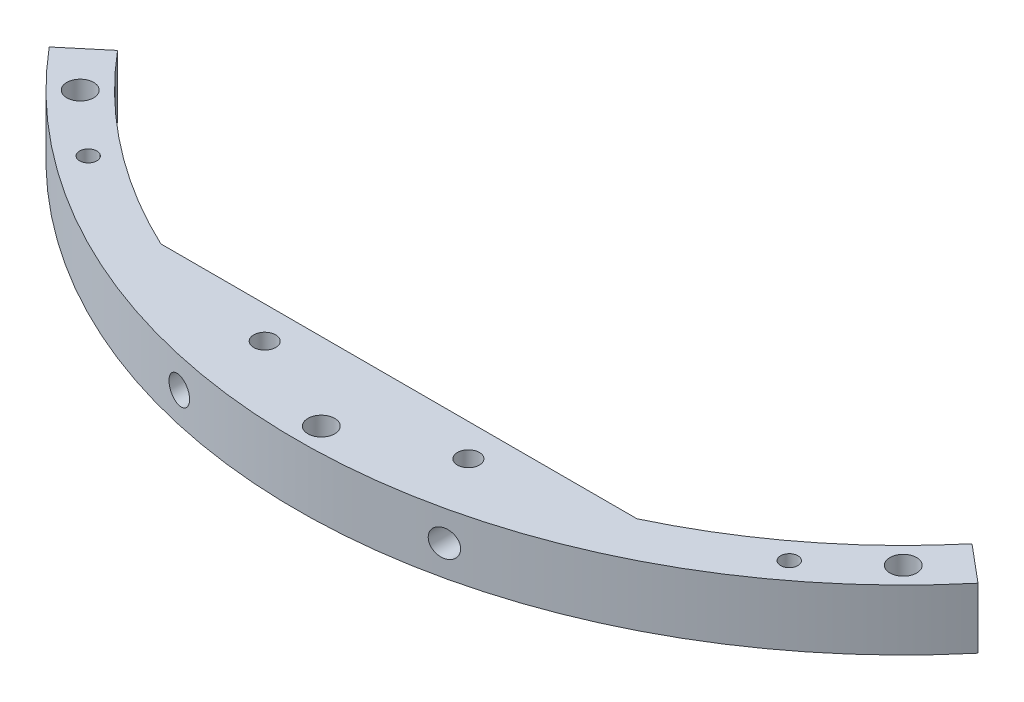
SolidWorks part; units mm, degrees
ref_plane "Front Plane" through (0, 0, 0) normal (0, 0, 1) x (1, 0, 0)
ref_plane "Top Plane" through (0, 0, 0) normal (0, 1, 0) x (1, 0, 0)
ref_plane "Right Plane" through (0, 0, 0) normal (1, 0, 0) x (0, 0, -1)
sketch "Sketch1" plane through (0, 0, 0) normal (0, 1, 0) x (1, 0, 0)
  line L0 (-67.1285, -56.3275) -> (-72.9657, -61.2255)
  line L1 (0, 0) -> (0, -103.3133) construction
  line L2 (67.1285, -56.3275) -> (72.9657, -61.2255)
  line L3 (37.4002, -79.248) -> (-37.4002, -79.248)
  arc A0 (-72.9657, -61.2255) -> (72.9657, -61.2255) centre (0, 0) ccw
  arc A1 (-67.1285, -56.3275) -> (-37.4002, -79.248) centre (0, 0) ccw
  circle A2 centre (-16.002, -84.328) radius 1.7272
  circle A3 centre (-64.6578, -64.6578) radius 2.1082
  circle A4 centre (-55.073, -72.9898) radius 1.3525
  circle A5 centre (55.073, -72.9898) radius 1.3525
  circle A6 centre (64.6578, -64.6578) radius 2.1082
  circle A7 centre (16.002, -84.328) radius 1.7272
  arc A8 (67.1285, -56.3275) -> (37.4002, -79.248) centre (0, 0) cw
  circle A9 centre (0, -91.44) radius 2.1082
  point P5 (0, -79.248)
  dimension "D1" = 50
  dimension "D4" = 3.4544
  dimension "D2" = 12.7
  dimension "D3" = 4.2164
  dimension "D5" = 2.7051
  dimension "D6" = 4.2164
  dimension "D7" = 87.63
  dimension "D8" = 95.25
  dimension "D10" = 16.002
  dimension "D11" = 3.3528
  dimension "D12" = 12.192
  dimension "D13" = 64.6578
  dimension "D14" = 14.5902
  dimension "D15" = 55.073
  dimension "D9" = 37.4002
  dimension "D16" = 7.62
extrude "Extrude1" add sketch "Sketch1" along normal blind 9.525
sketch "Sketch2" plane through (0, 9.525, 0) normal (0, 1, 0) x (-1, 0, 0)
  line L0 (64.6578, 64.6578) -> (61.9638, 61.9638) construction
  line L1 (0, 79.248) -> (0, 91.44) construction
  line L2 (-37.4002, 79.248) -> (37.4002, 79.248) construction
  line L3 (64.6578, 64.6578) -> (73.9393, 55.3764) construction
  line L4 (69.148, 60.1677) -> (65.9564, 56.9761)
  line L5 (-69.148, 60.1677) -> (-65.9564, 56.9761)
  arc A0 (67.1285, 56.3275) -> (37.4002, 79.248) centre (0, 0) ccw construction
  dimension "D1" = 90
  dimension "D2" = 6.35
sketch "Sketch3" plane through (0, 0, 79.248) normal (0, 0, -1) x (-1, 0, 0)
  line L0 (0, 0) -> (0, 9.5847) construction
  line L1 (-37.4002, 0) -> (37.4002, 0) construction
  circle A0 centre (20.828, 4.7625) radius 2.0828
  circle A1 centre (-20.828, 4.7625) radius 2.0828
extrude "Cut-Extrude1" cut sketch "Sketch3" against normal through all
